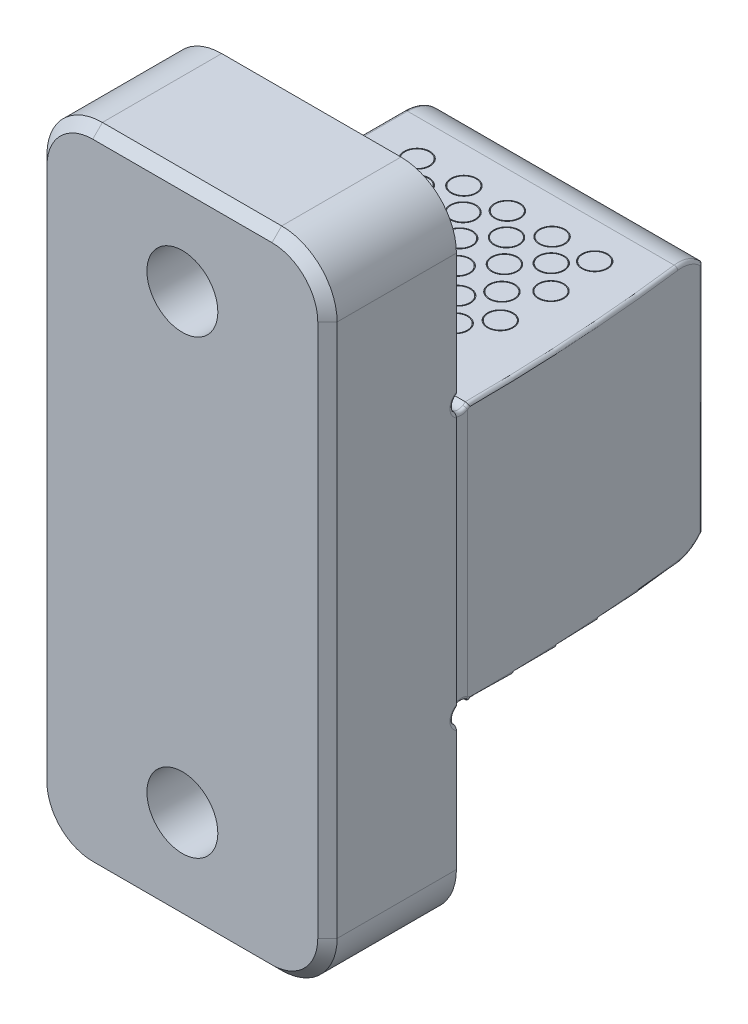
SolidWorks part; units mm, degrees
ref_plane "Front Plane" through (0, 0, 0) normal (0, 0, 1) x (1, 0, 0)
ref_plane "Top Plane" through (0, 0, 0) normal (0, 1, 0) x (1, 0, 0)
ref_plane "Right Plane" through (0, 0, 0) normal (1, 0, 0) x (0, 0, -1)
sketch "Sketch3" plane through (0, 0, 0) normal (1, 0, 0) x (0, 0, -1)
  line L0 (0, 19.8) -> (0, -19.8) construction
  line L1 (-20, -50) -> (0, -50)
  line L2 (-20, -50) -> (-20, 50)
  line L3 (-20, 50) -> (0, 50)
  line L4 (41.17, -19.9975) -> (41.17, 19.9975)
  line L6 (0, -50) -> (0, -19.9975)
  line L7 (0, -19.9975) -> (41.17, -19.9975)
  line L8 (0, 50) -> (0, 19.9975)
  line L9 (0, 19.9975) -> (41.17, 19.9975)
  line L10 (0, 0) -> (50000, 0) construction
  dimension "D1" = 61.17
  dimension "D2" = 20
  dimension "D3" = 100
  dimension "D4" = 39.995
extrude "Extrude1" add sketch "Sketch3" along normal mid plane 45
sketch "Sketch7" plane through (22.5, 0, 0) normal (1, 0, 0) x (0, 0, -1)
  line L0 (-20, -50) -> (0, -50) construction
  line L1 (0, -50) -> (52.6435, -50)
  line L2 (0, -50) -> (0, 50)
  line L3 (0, 50) -> (52.6435, 50)
  line L4 (52.6435, -50) -> (52.6435, 50)
  line L5 (0, -50) -> (0, -19.9975) construction
  line L6 (0, 50) -> (-20, 50) construction
extrude "Cut-Extrude3" cut sketch "Sketch7" against normal blind 0.25
sketch "Sketch8" plane through (22.5, 0, 0) normal (1, 0, 0) x (0, 0, -1)
  line L0 (0, 0) -> (50000, 0) construction
  line L1 (0, -50) -> (0, 50) construction
  line L2 (0, 19.9975) -> (41.17, 19.9975) construction
  circle A0 centre (1, 20.9975) radius 1.5
  circle A1 centre (1, -20.9975) radius 1.5
  dimension "D1" = 1.5
  dimension "D2" = 0.5
  dimension "D3" = 0.5
extrude "Cut-Extrude4" cut sketch "Sketch8" against normal through all
sketch "Sketch9" plane through (22.5, 0, 0) normal (1, 0, 0) x (0, 0, -1)
  line L0 (2.118, 19.9975) -> (41.17, 19.9975) construction
  line L1 (41.17, 19.9975) -> (41.17, -19.9975) construction
  line L2 (0, 0) -> (50000, 0) construction
  line L3 (41.17, 18.0805) -> (46.67, 18.0805)
  line L4 (36.67, 19.9975) -> (36.67, 28.0805)
  line L5 (36.67, 28.0805) -> (46.67, 28.0805)
  line L6 (46.67, 18.0805) -> (46.67, 28.0805)
  line L7 (46.67, -18.0805) -> (46.67, -28.0805)
  line L8 (36.67, -28.0805) -> (46.67, -28.0805)
  line L9 (36.67, -19.9975) -> (36.67, -28.0805)
  line L10 (41.17, -18.0805) -> (46.67, -18.0805)
  arc A0 (36.67, 19.9975) -> (40.0791, 19.5236) centre (36.67, 7.4975) cw construction
  arc A1 (40.0791, 19.5236) -> (41.17, 18.0805) centre (39.67, 18.0805) cw construction
  arc A2 (40.0791, -19.5236) -> (41.17, -18.0805) centre (39.67, -18.0805) ccw construction
  arc A3 (36.67, -19.9975) -> (40.0791, -19.5236) centre (36.67, -7.4975) ccw construction
  arc A4 (36.67, 19.9975) -> (41.17, 18.0805) centre (36.67, 13.7573) cw
  arc A5 (36.67, -19.9975) -> (41.17, -18.0805) centre (36.67, -13.7573) ccw
  dimension "D1" = 1.5
  dimension "D2" = 12.5
  dimension "D3" = 4.5
  dimension "D4" = 10
  dimension "D5" = 10
extrude "Cut-Extrude5" cut sketch "Sketch9" against normal through all
sketch "Sketch13" plane through (0, 50, 0) normal (0, 1, 0) x (1, 0, 0)
  line L0 (22.25, 2.118) -> (22.25, 36.67) construction
  line L2 (17.7495, 52) -> (67.7495, 52)
  line L4 (22.25, 2) -> (67.7495, 2)
  line L5 (67.7495, 52) -> (67.7495, 2)
  arc A0 (17.7495, 52) -> (22.25, 2) centre (-257.75, 2) cw
  dimension "D1" = 280
  dimension "D2" = 2
  dimension "D3" = 50
  dimension "D4" = 50
extrude "Cut-Extrude6" cut sketch "Sketch13" against normal through all
sketch "Sketch15" plane through (0, 19.9975, 0) normal (0, 1, 0) x (1, 0, 0)
  circle A0 centre (12.923, 31.0244) radius 2
  circle A1 centre (12.923, 31.0244) radius 1.87
  circle A2 centre (-0.6238, 31.0244) radius 2
  circle A3 centre (-0.6238, 31.0244) radius 1.87
  circle A4 centre (-14.6244, 31.0244) radius 2
  circle A5 centre (-14.6244, 31.0244) radius 1.87
  circle A6 centre (-7.3649, 31.0244) radius 2
  circle A7 centre (-7.3649, 31.0244) radius 1.87
  circle A8 centre (6.3116, 31.0244) radius 2
  circle A9 centre (6.3116, 31.0244) radius 1.87
  circle A10 centre (13.5329, 15.7763) radius 2
  circle A11 centre (13.5329, 15.7763) radius 1.87
  circle A12 centre (2.8763, 27.3946) radius 2
  circle A13 centre (2.8763, 27.3946) radius 1.87
  circle A14 centre (-11.1243, 27.3946) radius 2
  circle A15 centre (-11.1243, 27.3946) radius 1.87
  circle A16 centre (-3.8647, 27.3946) radius 2
  circle A17 centre (-3.8647, 27.3946) radius 1.87
  circle A18 centre (9.8118, 27.3946) radius 2
  circle A19 centre (9.8118, 27.3946) radius 1.87
  circle A20 centre (13.5329, 23.6352) radius 2
  circle A21 centre (13.5329, 23.6352) radius 1.87
  circle A22 centre (-0.6238, 23.6352) radius 2
  circle A23 centre (-0.6238, 23.6352) radius 1.87
  circle A24 centre (-14.6244, 23.6352) radius 2
  circle A25 centre (-14.6244, 23.6352) radius 1.87
  circle A26 centre (-7.3649, 23.6352) radius 2
  circle A27 centre (-7.3649, 23.6352) radius 1.87
  circle A28 centre (6.3116, 23.6352) radius 2
  circle A29 centre (6.3116, 23.6352) radius 1.87
  circle A30 centre (-0.0139, 15.7763) radius 2
  circle A31 centre (-0.0139, 15.7763) radius 1.87
  circle A32 centre (2.8763, 19.7461) radius 2
  circle A33 centre (2.8763, 19.7461) radius 1.87
  circle A34 centre (-11.1243, 19.7461) radius 2
  circle A35 centre (-11.1243, 19.7461) radius 1.87
  circle A36 centre (-3.8647, 19.7461) radius 2
  circle A37 centre (-3.8647, 19.7461) radius 1.87
  circle A38 centre (9.8118, 19.7461) radius 2
  circle A39 centre (9.8118, 19.7461) radius 1.87
  circle A40 centre (-14.0145, 15.7763) radius 2
  circle A41 centre (-14.0145, 15.7763) radius 1.87
  circle A42 centre (-6.7549, 15.7763) radius 2
  circle A43 centre (-6.7549, 15.7763) radius 1.87
  circle A44 centre (6.9216, 15.7763) radius 2
  circle A45 centre (6.9216, 15.7763) radius 1.87
  circle A46 centre (3.4862, 11.8873) radius 2
  circle A47 centre (3.4862, 11.8873) radius 1.87
  circle A48 centre (-10.5144, 11.8873) radius 2
  circle A49 centre (-10.5144, 11.8873) radius 1.87
  circle A50 centre (-3.2548, 11.8873) radius 2
  circle A51 centre (-3.2548, 11.8873) radius 1.87
  circle A52 centre (10.4217, 11.8873) radius 2
  circle A53 centre (10.4217, 11.8873) radius 1.87
  dimension "D3" = 4
  dimension "D4" = 3.74
extrude "Cut-Extrude7" cut sketch "Sketch15" against normal blind 0.254
mirror "Mirror1" about plane through (0, 0, 0) normal (0, 1, 0) of "Cut-Extrude7"
hole_wizard "CBORE for M10 SHCS1" positions "Sketch17" profile "Sketch16" counterbore size "M10" standard "Ansi Metric"
sketch "Sketch17" plane through (0, 0, 0) normal (0, 0, -1) x (-1, 0, 0)
  line L0 (0, 0) -> (50000, 0) construction
  point P0 (0, 35)
  point P9 (0, -35)
  dimension "D1" = 70
sketch "Sketch16" plane through (0, 35, 0) normal (1, 0, 0) x (0, 1, 0)
  line L0 (0, 0) -> (0, 20)
  line L1 (0, 20) -> (5.5, 20)
  line L3 (5.5, 20) -> (5.5, 11)
  line L4 (5.5, 11) -> (9, 11)
  line L5 (9, 11) -> (9, 0)
  line L7 (9, 0) -> (0, 0)
  line L11 (0, -6.35) -> (0, 107.95) construction
  dimension "Thru Hole Dia." = 11
  dimension "Thru Hole Depth" = 20
  dimension "C'Bore Dia." = 18
  dimension "C'Bore Depth" = 11
fillet "Fillet1" radius 8.6 4 edges at (-22.5, 50, 10) (-22.5, -50, 10) (22.5, -50, 10) (22.5, 50, 10)
chamfer "Chamfer1" distance 1.5 angle 45 8 edges at (0, 50, 20) (-19.9811, 47.4811, 20) (-22.5, 0, 20) (0, -50, 20) (-19.9811, -47.4811, 20) (22.5, 0, 20) (19.9811, 47.4811, 20) (19.9811, -47.4811, 20)
chamfer "Chamfer2" distance 0.4 angle 45 2 edges at (0, -26, 0) (0, 44, 0)
mirror "Mirror2" about plane through (0, 0, 0) normal (1, 0, 0) of "Cut-Extrude3"
fillet "Fillet2" radius 0.5 24 edges at (21.7071, 19.9975, -19.4273) (19.7309, -19.3315, -39.475) (19.8278, 19.6406, -38.75) (19.4967, 0, -41.17) (21.7071, -19.9975, -19.4273) (22.5, -20.9975, 0.5) (22.375, -19.8795, 0) (22.25, -19.4975, -1) (22.375, 19.8795, 0) (22.5, 20.9975, 0.5) (22.25, 19.4975, -1) (-22.5, -20.9975, 0.5) (-22.5, 20.9975, 0.5) (-22.25, -19.4983, -39.1157) (-22.25, 0, -41.17) (-22.25, 19.4983, -39.1157) (-22.25, -19.9975, -19.394) (-22.25, -19.4998, -1.0835) (-22.375, -19.8795, 0) (-22.25, 19.9975, -19.394) (-22.25, 19.4998, -1.0835) (-22.375, 19.8795, 0)
